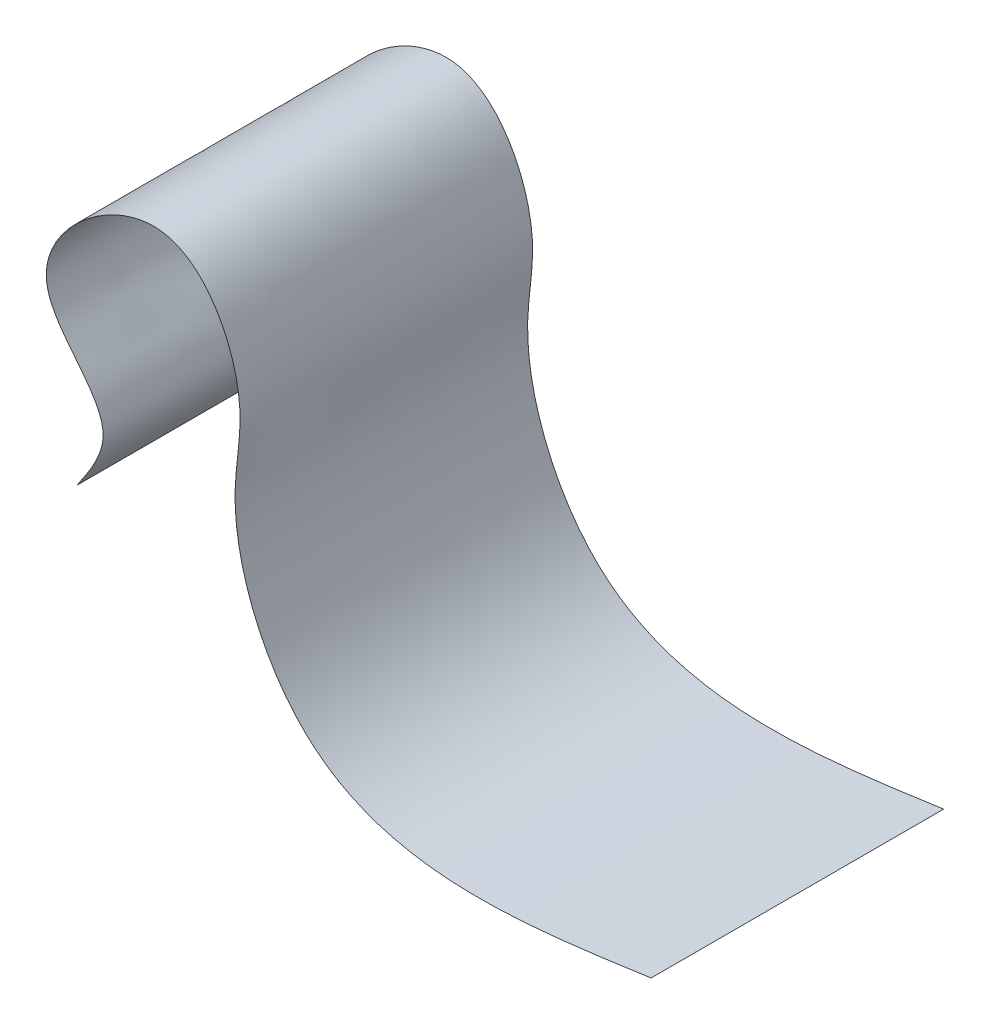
SolidWorks part; units mm, degrees
ref_plane "Front Plane" through (0, 0, 0) normal (0, 0, 1) x (1, 0, 0)
ref_plane "Top Plane" through (0, 0, 0) normal (0, 1, 0) x (1, 0, 0)
ref_plane "Right Plane" through (0, 0, 0) normal (1, 0, 0) x (0, 0, -1)
sketch "Sketch1" plane through (0, 0, 0) normal (0, 0, 1) x (1, 0, 0)
  spline S0 degree 3 poles (0, 0) (-15.8376, -2.2647) (-40.239, -5.754) (-51.068, 21.5857) (-47.4818, 36.5247) (-56.8657, 54.8208) (-79.0643, 36.1119) (-62.1652, 25.6346) (-66.6845, 18.982) (-68.2883, 16.6211) knots 0 0 0 0 0.322301 0.496576 0.566727 0.691645 0.833395 0.940876 1 1 1 1
surface "Surface-Extrude1" sketch "Sketch1" parameters "D1"=34.798
